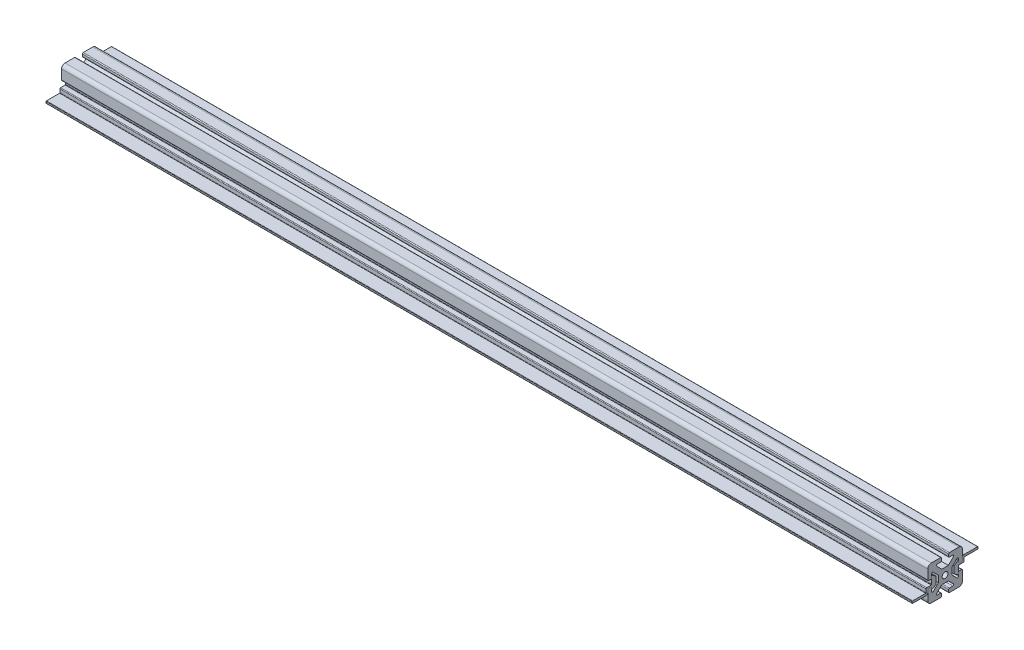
SolidWorks part; units mm, degrees
ref_plane "Ebene vorne" through (0, 0, 0) normal (0, 0, 1) x (1, 0, 0)
ref_plane "Ebene oben" through (0, 0, 0) normal (0, 1, 0) x (1, 0, 0)
ref_plane "Ebene rechts" through (0, 0, 0) normal (1, 0, 0) x (0, 0, -1)
sketch "Skizze1" plane through (0, 0, 0) normal (0, 1, 0) x (1, 0, 0)
  line L0 (0, 0) -> (1000, 0)
  line L1 (0, -15.5) -> (1000, -15.5)
  line L2 (0, -31) -> (1000, -31)
  dimension "D1" = 1000
  dimension "D2" = 1000
  dimension "D3" = 15.5
  dimension "D4" = 1000
  dimension "D5" = 15.5
other "Strukturbauteil1"
ref_plane "Ebene1" through (0, 0, 0) normal (1, 0, 0) x (0, -1, 0)
sketch "Model" plane through (0, 0, 0) normal (1, 0, 0) x (0, -1, 0)
  line L0 (-4, -5) -> (4, -5)
  line L1 (6.6, 0) -> (-1.6, 0)
  line L2 (-2.1, 0.5) -> (-2.1, 5.7)
  line L3 (-2.9, 6.5) -> (-6.8, 6.5)
  line L4 (-7.1, 6.8) -> (-7.1, 22)
  line L5 (-7.6, 22.5) -> (-9.1, 22.5)
  line L6 (-9.6, 22) -> (-9.6, 6.5)
  line L7 (-7.6, 4.5) -> (-5.6, 4.5)
  line L8 (-4.1, 3) -> (-4.1, 1)
  line L9 (-5.1, 0) -> (-6.6, 0)
  line L10 (-6.6, 0) -> (6.6, 0) construction
  line L11 (-6.8797, -0.4085) -> (-6.701, -0.8493)
  line L12 (-6.701, -0.8493) -> (-6.5094, -1.2846)
  line L13 (-6.5094, -1.2846) -> (-6.3048, -1.7139)
  line L14 (-6.3048, -1.7139) -> (-6.0876, -2.137)
  line L15 (-6.0876, -2.137) -> (-5.858, -2.5535)
  line L16 (-5.858, -2.5535) -> (-5.616, -2.963)
  line L17 (-5.616, -2.963) -> (-5.362, -3.365)
  line L18 (-5.362, -3.365) -> (-5.0962, -3.7594)
  line L19 (-5.0962, -3.7594) -> (-4.8187, -4.1457)
  line L20 (-4.8187, -4.1457) -> (-4.5299, -4.5235)
  line L21 (-4.5299, -4.5235) -> (-4.23, -4.8926)
  line L22 (4.23, -4.8926) -> (4.5299, -4.5235)
  line L23 (4.5299, -4.5235) -> (4.8187, -4.1457)
  line L24 (4.8187, -4.1457) -> (5.0962, -3.7594)
  line L25 (5.0962, -3.7594) -> (5.362, -3.365)
  line L26 (5.362, -3.365) -> (5.616, -2.963)
  line L27 (5.616, -2.963) -> (5.858, -2.5535)
  line L28 (5.858, -2.5535) -> (6.0876, -2.137)
  line L29 (6.0876, -2.137) -> (6.3048, -1.7139)
  line L30 (6.3048, -1.7139) -> (6.5094, -1.2846)
  line L31 (6.5094, -1.2846) -> (6.701, -0.8493)
  line L32 (6.701, -0.8493) -> (6.8797, -0.4085)
  arc A0 (-6.6, 0) -> (-6.8797, -0.4085) centre (-6.6, -0.3) ccw
  arc A2 (-4.23, -4.8926) -> (-4, -5) centre (-4, -4.7) ccw
  arc A3 (4, -5) -> (4.23, -4.8926) centre (4, -4.7) ccw
  arc A5 (6.8797, -0.4085) -> (6.6, 0) centre (6.6, -0.3) ccw
  arc A6 (-2.1, 0.5) -> (-1.6, 0) centre (-1.6, 0.5) ccw
  arc A7 (-2.1, 5.7) -> (-2.9, 6.5) centre (-2.9, 5.7) ccw
  arc A8 (-7.1, 6.8) -> (-6.8, 6.5) centre (-6.8, 6.8) ccw
  arc A9 (-7.1, 22) -> (-7.6, 22.5) centre (-7.6, 22) ccw
  arc A10 (-9.1, 22.5) -> (-9.6, 22) centre (-9.1, 22) ccw
  arc A11 (-9.6, 6.5) -> (-7.6, 4.5) centre (-7.6, 6.5) ccw
  arc A12 (-4.1, 3) -> (-5.6, 4.5) centre (-5.6, 3) ccw
  arc A13 (-5.1, 0) -> (-4.1, 1) centre (-5.1, 1) ccw
  point P38 (4.5299, -4.5235)
  point P39 (0, 0)
  point P40 (4.8187, -4.1457)
  point P42 (5.0962, -3.7594)
  point P43 (5.362, -3.365)
  point P44 (5.616, -2.963)
  point P45 (5.858, -2.5535)
  point P46 (6.0876, -2.137)
  point P47 (6.3048, -1.7139)
  point P48 (6.5094, -1.2846)
  point P49 (6.701, -0.8493)
  point P50 (-6.701, -0.8493)
  point P51 (-6.5094, -1.2846)
  point P52 (-6.3048, -1.7139)
  point P53 (-6.0876, -2.137)
  point P54 (-5.858, -2.5535)
  point P55 (-5.616, -2.963)
  point P56 (-5.362, -3.365)
  point P57 (-5.0962, -3.7594)
  point P58 (-4.8187, -4.1457)
  point P59 (-4.5299, -4.5235)
  point P78 (0, 0)
other "Strukturbauteil3"
ref_plane "Ebene4" through (0, 0, 15.5) normal (1, 0, 0) x (0, 0, -1)
sketch "Model3" plane through (0, 0, 15.5) normal (1, 0, 0) x (0, 0, -1)
  line L0 (-18.5, -4) -> (-16.5, -4)
  line L1 (-15.5, -5) -> (-15.5, -8.9161)
  line L3 (-15.5, 8.9161) -> (-15.5, 5)
  line L4 (-16.5, 4) -> (-18.5, 4)
  line L5 (-20, 5) -> (-20, 16)
  line L6 (-16, 20) -> (-5.5, 20)
  line L7 (-4, 18.5) -> (-4, 16.5)
  line L8 (-5, 15.5) -> (-8.9161, 15.5)
  line L9 (9.7888, 13.7733) -> (3.7935, 7.75)
  line L10 (8.9161, 15.5) -> (5, 15.5)
  line L11 (4, 16.5) -> (4, 18.5)
  line L12 (5.5, 20) -> (16, 20)
  line L13 (20, 16) -> (20, 5.5)
  line L14 (18.5, 4) -> (16.5, 4)
  line L15 (15.5, 5) -> (15.5, 8.9161)
  line L16 (3.7935, 7.75) -> (-3.7935, 7.75)
  line L17 (15.5, -8.9161) -> (15.5, -5)
  line L18 (16.5, -4) -> (18.5, -4)
  line L19 (20, -5.5) -> (20, -16)
  line L20 (16, -20) -> (5.5, -20)
  line L21 (4, -18.5) -> (4, -16.5)
  line L22 (5, -15.5) -> (8.9161, -15.5)
  line L23 (-9.7888, 13.7733) -> (-3.7935, 7.75)
  line L24 (-8.9161, -15.5) -> (-5, -15.5)
  line L25 (-4, -16.5) -> (-4, -18.5)
  line L26 (-5.5, -20) -> (-16, -20)
  line L27 (-20, -16) -> (-20, -5)
  line L28 (-19, 4) -> (-18.5, 4)
  line L29 (-20, -20) -> (20, -20) construction
  line L30 (-20, -20) -> (-20, -4) construction
  line L31 (-20, 20) -> (20, 20) construction
  line L32 (20, -20) -> (20, 20) construction
  line L33 (-20, -20) -> (20, 20) construction
  line L34 (-20, 20) -> (20, -20) construction
  line L35 (-18.5, -4) -> (-19, -4)
  line L36 (-7.75, 3.7935) -> (-7.75, -3.7935)
  line L37 (-5.5, -20) -> (-5, -20)
  line L38 (-4, -19) -> (-4, -18.5)
  line L39 (5.5, -20) -> (5, -20)
  line L40 (4, -19) -> (4, -18.5)
  line L41 (20, -5.5) -> (20, -5)
  line L42 (19, -4) -> (18.5, -4)
  line L43 (18.5, 4) -> (19, 4)
  line L44 (20, 5) -> (20, 5.5)
  line L45 (5.5, 20) -> (5, 20)
  line L46 (4, 19) -> (4, 18.5)
  line L47 (-20, -4) -> (-20, 20) construction
  line L48 (-4, 18.5) -> (-4, 19)
  line L49 (-5, 20) -> (-5.5, 20)
  line L50 (-13.7733, 9.7888) -> (-7.75, 3.7935)
  line L51 (-13.7733, -9.7888) -> (-7.75, -3.7935)
  line L52 (13.7733, -9.7888) -> (7.75, -3.7935)
  line L53 (7.75, -3.7935) -> (7.75, 3.7935)
  line L54 (13.7733, 9.7888) -> (7.75, 3.7935)
  line L55 (-9.7888, -13.7733) -> (-3.7935, -7.75)
  line L56 (-3.7935, -7.75) -> (3.7935, -7.75)
  line L57 (9.7888, -13.7733) -> (3.7935, -7.75)
  circle A0 centre (0, 0) radius 3.4
  arc A1 (-20, 16) -> (-16, 20) centre (-16, 16) cw
  arc A2 (-15.5, -5) -> (-16.5, -4) centre (-16.5, -5) ccw
  arc A3 (-15.5, -8.9161) -> (-13.7733, -9.7888) centre (-14.4161, -8.9161) ccw
  arc A4 (-4, 19) -> (-5, 20) centre (-5, 19) ccw
  arc A5 (5, 20) -> (4, 19) centre (5, 19) ccw
  arc A6 (19, 4) -> (20, 5) centre (19, 5) ccw
  arc A7 (20, -5) -> (19, -4) centre (19, -5) ccw
  arc A8 (-13.7733, 9.7888) -> (-15.5, 8.9161) centre (-14.4161, 8.9161) ccw
  arc A9 (-16.5, 4) -> (-15.5, 5) centre (-16.5, 5) ccw
  arc A10 (5, -20) -> (4, -19) centre (5, -19) cw
  arc A11 (-5, -20) -> (-4, -19) centre (-5, -19) ccw
  arc A12 (-19, -4) -> (-20, -5) centre (-19, -5) ccw
  arc A13 (-5, 15.5) -> (-4, 16.5) centre (-5, 16.5) ccw
  arc A14 (-8.9161, 15.5) -> (-9.7888, 13.7733) centre (-8.9161, 14.4161) ccw
  arc A15 (-19, 4) -> (-20, 5) centre (-19, 5) cw
  arc A19 (9.7888, 13.7733) -> (8.9161, 15.5) centre (8.9161, 14.4161) ccw
  arc A20 (4, 16.5) -> (5, 15.5) centre (5, 16.5) ccw
  arc A22 (20, 16) -> (16, 20) centre (16, 16) ccw
  arc A24 (15.5, 5) -> (16.5, 4) centre (16.5, 5) ccw
  arc A25 (15.5, 8.9161) -> (13.7733, 9.7888) centre (14.4161, 8.9161) ccw
  arc A30 (13.7733, -9.7888) -> (15.5, -8.9161) centre (14.4161, -8.9161) ccw
  arc A31 (16.5, -4) -> (15.5, -5) centre (16.5, -5) ccw
  arc A33 (16, -20) -> (20, -16) centre (16, -16) ccw
  arc A35 (5, -15.5) -> (4, -16.5) centre (5, -16.5) ccw
  arc A36 (8.9161, -15.5) -> (9.7888, -13.7733) centre (8.9161, -14.4161) ccw
  arc A41 (-9.7888, -13.7733) -> (-8.9161, -15.5) centre (-8.9161, -14.4161) ccw
  arc A42 (-4, -16.5) -> (-5, -15.5) centre (-5, -16.5) ccw
  arc A44 (-20, -16) -> (-16, -20) centre (-16, -16) ccw
  point P12 (-4, 20)
  point P46 (0, 0)
  point P47 (4, 20)
  point P68 (20, 4)
  point P72 (20, -4)
  point P76 (4, -20)
  point P97 (-4, -20)
  point P104 (-20, 4)
  point P106 (0, 0)
  point P122 (0, 20)
  point P123 (-20, 0)
  point P124 (0, -20)
  point P125 (20, 0)
  dimension "D1" = 4
  dimension "D3" = 1
  dimension "D2" = 4
ref_plane "Ebene6" through (0, 0, 31) normal (1, 0, 0) x (0, 0, -1)
ref_plane "Ebene7" through (0, 0, 31) normal (1, 0, 0) x (0, 0, -1)
ref_plane "Ebene8" through (0, 0, 31) normal (1, 0, 0) x (0, 0, -1)
ref_plane "Ebene9" through (0, 0, 31) normal (1, 0, 0) x (0, 0, -1)
other "Strukturbauteil4"
ref_plane "Ebene10" through (0, 0, 31) normal (1, 0, 0) x (0, 1, 0)
sketch "Model4" plane through (0, 0, 31) normal (1, 0, 0) x (0, 1, 0)
  line L0 (-4, -5) -> (4, -5)
  line L1 (6.6, 0) -> (-1.6, 0)
  line L2 (-2.1, 0.5) -> (-2.1, 5.7)
  line L3 (-2.9, 6.5) -> (-6.8, 6.5)
  line L4 (-7.1, 6.8) -> (-7.1, 22)
  line L5 (-7.6, 22.5) -> (-9.1, 22.5)
  line L6 (-9.6, 22) -> (-9.6, 6.5)
  line L7 (-7.6, 4.5) -> (-5.6, 4.5)
  line L8 (-4.1, 3) -> (-4.1, 1)
  line L9 (-5.1, 0) -> (-6.6, 0)
  line L10 (-6.6, 0) -> (6.6, 0) construction
  line L11 (-6.8797, -0.4085) -> (-6.701, -0.8493)
  line L12 (-6.701, -0.8493) -> (-6.5094, -1.2846)
  line L13 (-6.5094, -1.2846) -> (-6.3048, -1.7139)
  line L14 (-6.3048, -1.7139) -> (-6.0876, -2.137)
  line L15 (-6.0876, -2.137) -> (-5.858, -2.5535)
  line L16 (-5.858, -2.5535) -> (-5.616, -2.963)
  line L17 (-5.616, -2.963) -> (-5.362, -3.365)
  line L18 (-5.362, -3.365) -> (-5.0962, -3.7594)
  line L19 (-5.0962, -3.7594) -> (-4.8187, -4.1457)
  line L20 (-4.8187, -4.1457) -> (-4.5299, -4.5235)
  line L21 (-4.5299, -4.5235) -> (-4.23, -4.8926)
  line L22 (4.23, -4.8926) -> (4.5299, -4.5235)
  line L23 (4.5299, -4.5235) -> (4.8187, -4.1457)
  line L24 (4.8187, -4.1457) -> (5.0962, -3.7594)
  line L25 (5.0962, -3.7594) -> (5.362, -3.365)
  line L26 (5.362, -3.365) -> (5.616, -2.963)
  line L27 (5.616, -2.963) -> (5.858, -2.5535)
  line L28 (5.858, -2.5535) -> (6.0876, -2.137)
  line L29 (6.0876, -2.137) -> (6.3048, -1.7139)
  line L30 (6.3048, -1.7139) -> (6.5094, -1.2846)
  line L31 (6.5094, -1.2846) -> (6.701, -0.8493)
  line L32 (6.701, -0.8493) -> (6.8797, -0.4085)
  arc A0 (-6.6, 0) -> (-6.8797, -0.4085) centre (-6.6, -0.3) ccw
  arc A2 (-4.23, -4.8926) -> (-4, -5) centre (-4, -4.7) ccw
  arc A3 (4, -5) -> (4.23, -4.8926) centre (4, -4.7) ccw
  arc A5 (6.8797, -0.4085) -> (6.6, 0) centre (6.6, -0.3) ccw
  arc A6 (-2.1, 0.5) -> (-1.6, 0) centre (-1.6, 0.5) ccw
  arc A7 (-2.1, 5.7) -> (-2.9, 6.5) centre (-2.9, 5.7) ccw
  arc A8 (-7.1, 6.8) -> (-6.8, 6.5) centre (-6.8, 6.8) ccw
  arc A9 (-7.1, 22) -> (-7.6, 22.5) centre (-7.6, 22) ccw
  arc A10 (-9.1, 22.5) -> (-9.6, 22) centre (-9.1, 22) ccw
  arc A11 (-9.6, 6.5) -> (-7.6, 4.5) centre (-7.6, 6.5) ccw
  arc A12 (-4.1, 3) -> (-5.6, 4.5) centre (-5.6, 3) ccw
  arc A13 (-5.1, 0) -> (-4.1, 1) centre (-5.1, 1) ccw
  point P38 (4.5299, -4.5235)
  point P39 (0, 0)
  point P40 (4.8187, -4.1457)
  point P42 (5.0962, -3.7594)
  point P43 (5.362, -3.365)
  point P44 (5.616, -2.963)
  point P45 (5.858, -2.5535)
  point P46 (6.0876, -2.137)
  point P47 (6.3048, -1.7139)
  point P48 (6.5094, -1.2846)
  point P49 (6.701, -0.8493)
  point P50 (-6.701, -0.8493)
  point P51 (-6.5094, -1.2846)
  point P52 (-6.3048, -1.7139)
  point P53 (-6.0876, -2.137)
  point P54 (-5.858, -2.5535)
  point P55 (-5.616, -2.963)
  point P56 (-5.362, -3.365)
  point P57 (-5.0962, -3.7594)
  point P58 (-4.8187, -4.1457)
  point P59 (-4.5299, -4.5235)
  point P78 (0, 0)
